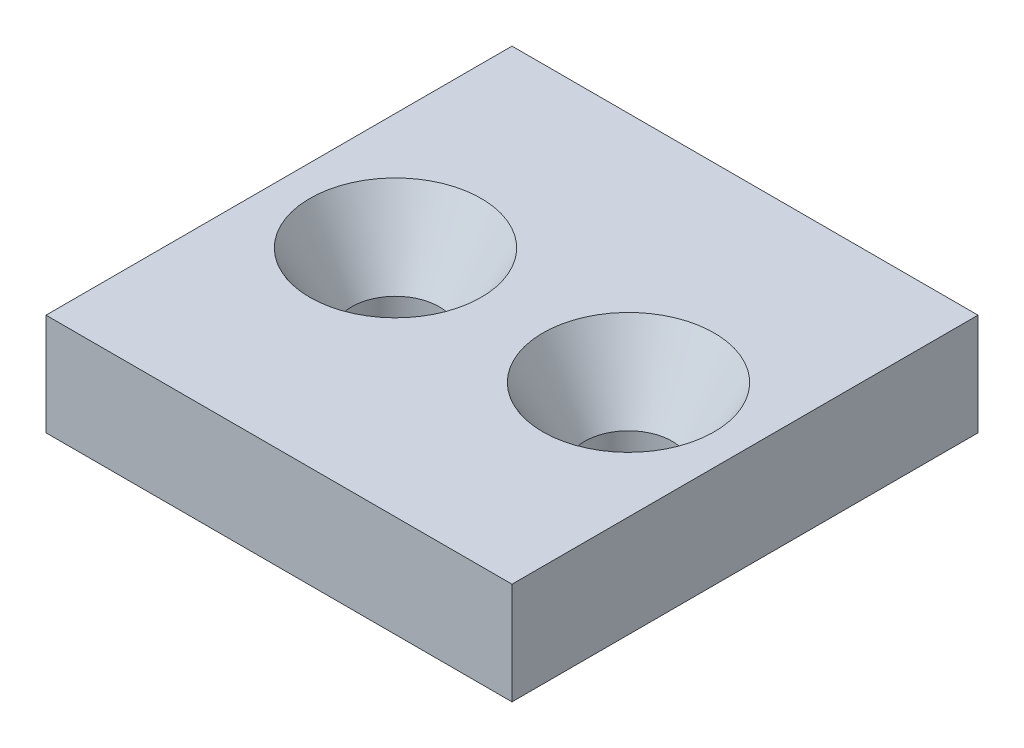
SolidWorks part; units mm, degrees
ref_plane "Front Plane" through (0, 0, 0) normal (0, 0, 1) x (1, 0, 0)
ref_plane "Top Plane" through (0, 0, 0) normal (0, 1, 0) x (1, 0, 0)
ref_plane "Right Plane" through (0, 0, 0) normal (1, 0, 0) x (0, 0, -1)
sketch "Sketch1" plane through (0, 0, 0) normal (0, 1, 0) x (1, 0, 0)
  line L1 (-16, -16) -> (16, -16)
  line L2 (-16, -16) -> (-16, 16)
  line L3 (-16, 16) -> (16, 16)
  line L4 (16, -16) -> (16, 16)
  line L5 (-16, -16) -> (16, 16) construction
  line L6 (-16, 16) -> (16, -16) construction
  point P0 (0, 0)
  dimension "D1" = 32
extrude "Boss-Extrude1" add sketch "Sketch1" along normal blind 7
hole_wizard "CSK for M6 Flat Head Machine Screw1" positions "Sketch3" profile "Sketch2" countersink size "M6" standard "Ansi Metric"
sketch "Sketch3" plane through (0, 7, 0) normal (0, 1, 0) x (-1, 0, 0)
  line L0 (-16, 16) -> (-16, -16) construction
  point P0 (8, 0)
  point P1 (-8, 0)
  dimension "D1" = 8
  dimension "D2" = 16
sketch "Sketch2" plane through (-8, 7, 0) normal (1, 0, 0) x (0, 0, 1)
  line L0 (0, 0) -> (0, 7)
  line L1 (0, 7) -> (3, 7)
  line L2 (3, 7) -> (3, 4.997)
  line L3 (3, 4.997) -> (5.885, 0)
  line L5 (5.885, 0) -> (0, 0)
  line L6 (-3, 4.997) -> (-5.885, 0) construction
  line L11 (0, -6.35) -> (0, 107.95) construction
  dimension "Thru Hole Dia." = 6
  dimension "Thru Hole Depth" = 7
  dimension "Near C'Sink Dia." = 11.77
  dimension "Near C'Sink Angle" = 60
